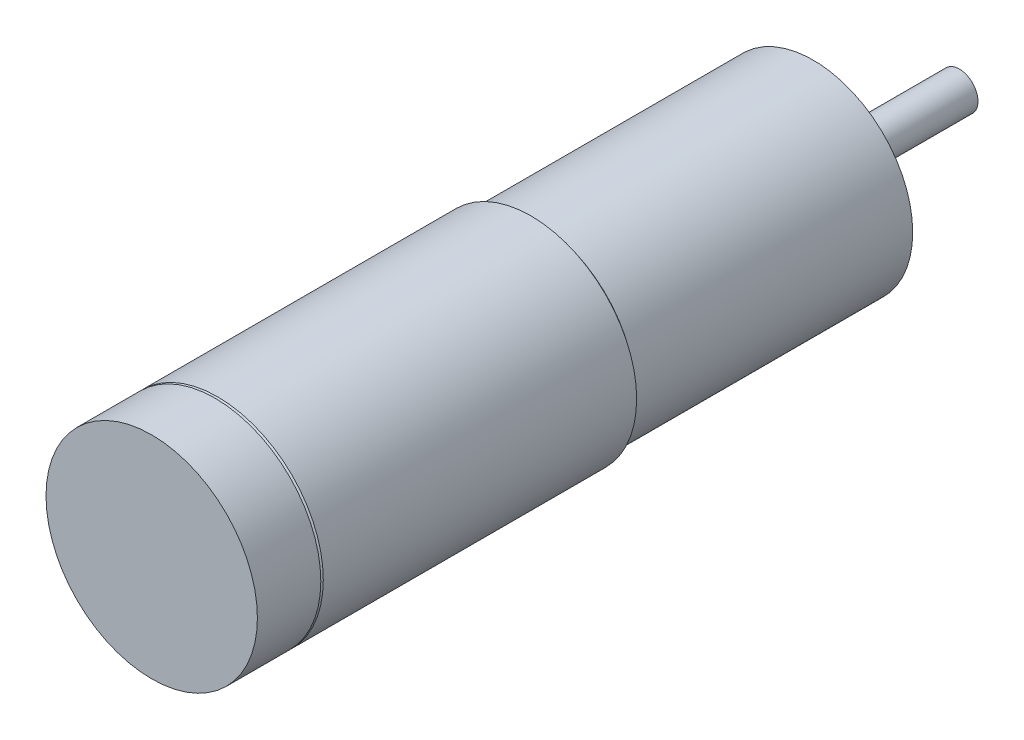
SolidWorks part; units mm, degrees
ref_plane "Front" through (0, 0, 0) normal (0, 0, 1) x (1, 0, 0)
ref_plane "Top" through (0, 0, 0) normal (0, 1, 0) x (1, 0, 0)
ref_plane "Right" through (0, 0, 0) normal (1, 0, 0) x (0, 0, -1)
sketch "Sketch1" plane through (0, 0, 0) normal (0, 0, 1) x (1, 0, 0)
  circle A0 centre (0, 0) radius 8
  dimension "D1" = 16
extrude "#143703" add sketch "Sketch1" along normal blind 22.7
chamfer "Chamfer1" distance 0.381 angle 45
sketch "Sketch2" plane through (0, 0, 22.7) normal (0, 0, 1) x (1, 0, 0)
  circle A0 centre (0, 0) radius 8.5
  circle A2 centre (0, 0) radius 8 construction
  dimension "D1" = 17
extrude "REmax17-216010" add sketch "Sketch2" along normal blind 25.4
sketch "Sketch3" plane through (0, 0, 0) normal (0, 0, -1) x (-1, 0, 0)
  circle A0 centre (0, 0) radius 3
  circle A1 centre (0, 0) radius 8 construction
  dimension "D1" = 6
extrude "Extrude3" add sketch "Sketch3" along normal blind 2.6
sketch "Sketch5" plane through (0, 0, 0) normal (0, 0, -1) x (-1, 0, 0)
  circle A0 centre (0, 0) radius 1.5
  circle A1 centre (0, 0) radius 8 construction
  dimension "D1" = 3
extrude "Extrude4" add sketch "Sketch5" along normal blind 11.75
chamfer "Chamfer2" distance 0.2 angle 45
sketch "Sketch6" plane through (0, 0, 48.1) normal (0, 0, 1) x (1, 0, 0)
  circle A0 centre (0, 0) radius 8.5
  circle A1 centre (0, 0) radius 8.5 construction
extrude "Extrude5" add sketch "Sketch6" along normal blind 5.1
